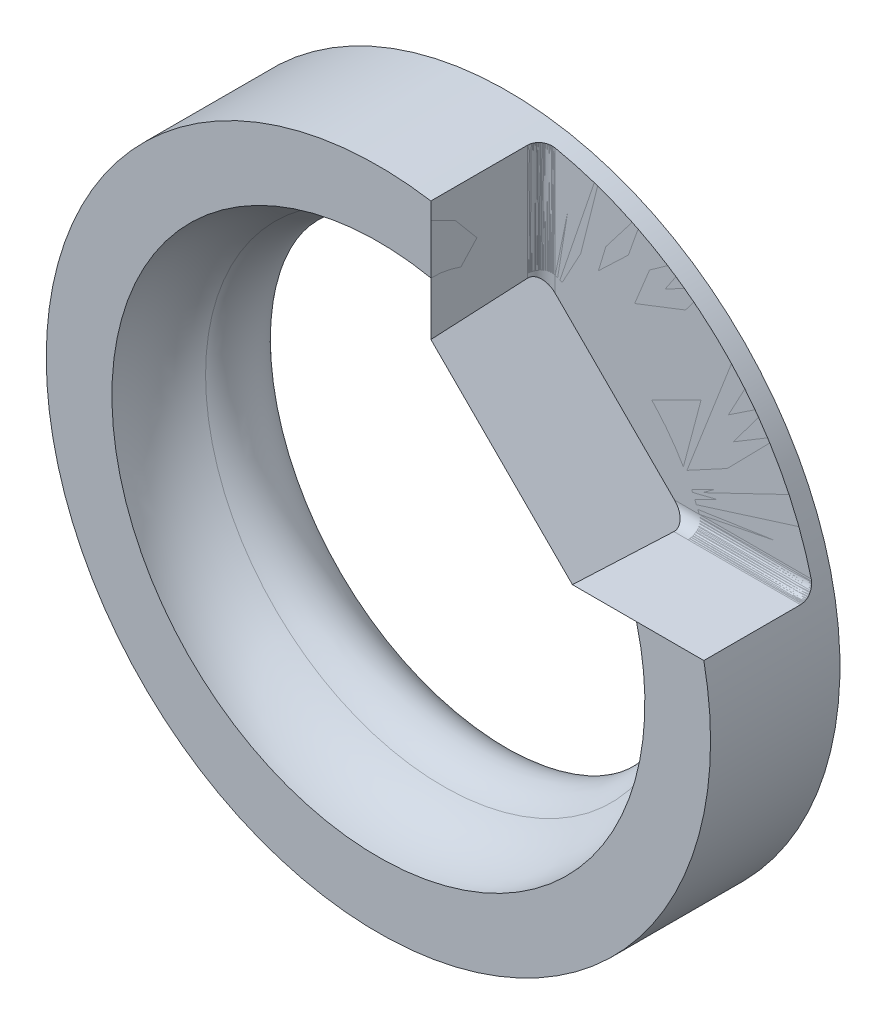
SolidWorks part; units mm, degrees
ref_plane "Ebene vorne" through (0, 0, 0) normal (0, 0, 1) x (1, 0, 0)
ref_plane "Ebene oben" through (0, 0, 0) normal (0, 1, 0) x (1, 0, 0)
ref_plane "Ebene rechts" through (0, 0, 0) normal (1, 0, 0) x (0, 0, -1)
sketch "Skizze2" plane through (0, 0, 0) normal (1, 0, 0) x (0, 0, -1)
  line L0 (0, 0) -> (-50.9559, 0) construction
  line L2 (0, 72.1351) -> (-28.0991, 72.1351)
  line L3 (0, 72.1351) -> (0, 51.585)
  line L5 (-28.0991, 72.1351) -> (-28.0991, 57.8758)
  arc A0 (-28.0991, 57.8758) -> (-14.0496, 51.585) centre (-28.0991, 39.0417) cw
  arc A1 (-14.0496, 51.585) -> (0, 51.585) centre (-7.0248, 57.8566) ccw
revolve "Rotation1" add sketch "Skizze2" angle 360 about L0
sketch "Skizze3" plane through (0, 0, 28.0991) normal (0, 0, 1) x (1, 0, 0)
  line L1 (11.4006, 14.4307) -> (76.4488, 14.4307)
  line L2 (11.4006, 14.4307) -> (11.4006, 76.9827)
  line L3 (11.4006, 76.9827) -> (76.4488, 76.9827)
  line L4 (76.4488, 14.4307) -> (76.4488, 76.9827)
extrude "Schnitt-Linear austragen1" cut sketch "Skizze3" against normal blind 24
fillet "Verrundung1" radius 3 2 edges at (58.7025, 14.4307, 4.0991) (11.4006, 59.3933, 4.0991)
surface "Oberfläche-Offset1" parameters "D1"=0
surface "Oberfläche-Verlängern1" parameters "D1"=20, "D2"=20, "D3"=20, "D4"=20, "D5"=20, "D6"=20, "D7"=20
sketch "Skizze5" plane through (0, 0, 28.0991) normal (0, 0, 1) x (1, 0, 0)
  line L0 (8.1552, 48.4133) -> (46.5824, 9.9862) construction
  line L1 (0, 0) -> (30.451, 0) construction
  dimension "D1" = 45
  dimension "D2" = 40
ref_plane "Ebene1" through (28.9428, 28.9428, 1.4294) normal (-0.7067, -0.7067, -0.0349) x (0.4826, -0.5174, 0.7067)
surface "Oberfläche-Trimmen1"
sketch "Skizze6" plane through (28.9428, 28.9428, 1.4294) normal (-0.7067, -0.7067, -0.0349) x (0.4826, -0.5174, 0.7067)
  line L0 (32.7235, 5.0163) -> (18.3837, -10.3606) construction
  line L1 (13.3352, -9.5573) -> (-12.5873, 16.3653) construction
  line L2 (-13.3906, 21.4138) -> (1.9862, 35.7536) construction
  line L3 (-1.2592, 38.999) -> (37.168, 0.5718) construction
  line L4 (32.7235, 5.0163) -> (18.3837, -10.3606)
  line L5 (13.3352, -9.5573) -> (-12.5873, 16.3653)
  line L6 (-13.3906, 21.4138) -> (1.9862, 35.7536)
  line L7 (1.9862, 35.7536) -> (32.7235, 5.0163)
  ellipse E0 centre (15.3837, -7.3606) end of major axis (18.279, -10.4653) minor radius 3 (13.3352, -9.5573) -> (18.3837, -10.3606) ccw construction
  ellipse E1 centre (-10.3906, 18.4138) end of major axis (-13.4953, 21.3091) minor radius 3 (-13.3906, 21.4138) -> (-12.5873, 16.3653) ccw construction
  ellipse E2 centre (15.3837, -7.3606) end of major axis (18.279, -10.4653) minor radius 3 (13.3352, -9.5573) -> (18.3837, -10.3606) ccw
  ellipse E3 centre (-10.3906, 18.4138) end of major axis (-13.4953, 21.3091) minor radius 3 (-13.3906, 21.4138) -> (-12.5873, 16.3653) ccw
surface "Oberfläche-Ebene1" sketch "Skizze6"
